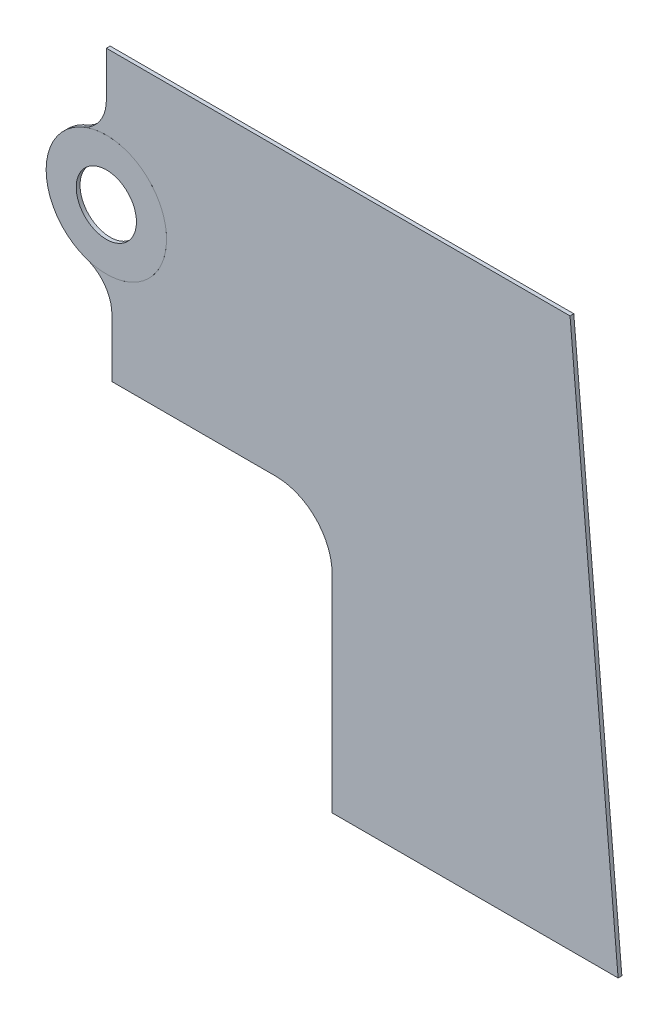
SolidWorks part; units mm, degrees
ref_plane "Front Plane" through (0, 0, 0) normal (0, 0, 1) x (1, 0, 0)
ref_plane "Top Plane" through (0, 0, 0) normal (0, 1, 0) x (1, 0, 0)
ref_plane "Right Plane" through (0, 0, 0) normal (1, 0, 0) x (0, 0, -1)
sketch "Sketch1" plane through (0, 0, 0) normal (0, 0, 1) x (1, 0, 0)
  line L0 (0, 0) -> (0, 55)
  line L1 (-60, 133.9951) -> (-60, 145.9951)
  line L2 (-58.5226, 85.4316) -> (-58.5226, 70)
  line L3 (76, 0) -> (63.2271, 145.9951)
  line L5 (76, 0) -> (0, 0)
  line L6 (-58.5226, 70) -> (-15, 70)
  line L7 (-60, 145.9951) -> (63.2271, 145.9951)
  arc A0 (-65.2447, 94.8791) -> (-66.1538, 124.7643) centre (-60, 109.9951) cw
  circle A1 centre (-60, 109.9951) radius 8
  arc A2 (-15, 70) -> (0, 55) centre (-15, 55) cw
  arc A3 (-65.2447, 94.8791) -> (-58.5226, 85.4316) centre (-68.5226, 85.4316) cw
  arc A4 (-60, 133.9951) -> (-66.1538, 124.7643) centre (-70, 133.9951) cw
  point P12 (0, 70)
  point P17 (-60, 125.9951)
  dimension "D2" = 15
  dimension "D6" = 16
  dimension "D7" = 10
  dimension "D8" = 16
  dimension "D13" = 10
  dimension "D1" = 70
  dimension "D3" = 60
  dimension "D4" = 76
  dimension "D5" = 75.9951
  dimension "D9" = 20
  dimension "D10" = 85
  dimension "D11" = 0
  dimension "D12" = 15.4316
extrude "Boss-Extrude1" add sketch "Sketch1" along normal blind 1
sketch "Sketch2" plane through (0, 0, 1) normal (0, 0, 1) x (1, 0, 0)
  circle A0 centre (-60, 109.9951) radius 16
  arc A1 (-66.1538, 124.7643) -> (-65.2447, 94.8791) centre (-60, 109.9951) ccw construction
split "Split1" trim tools "Sketch2" bodies to split 101 resulting bodies 102 103
